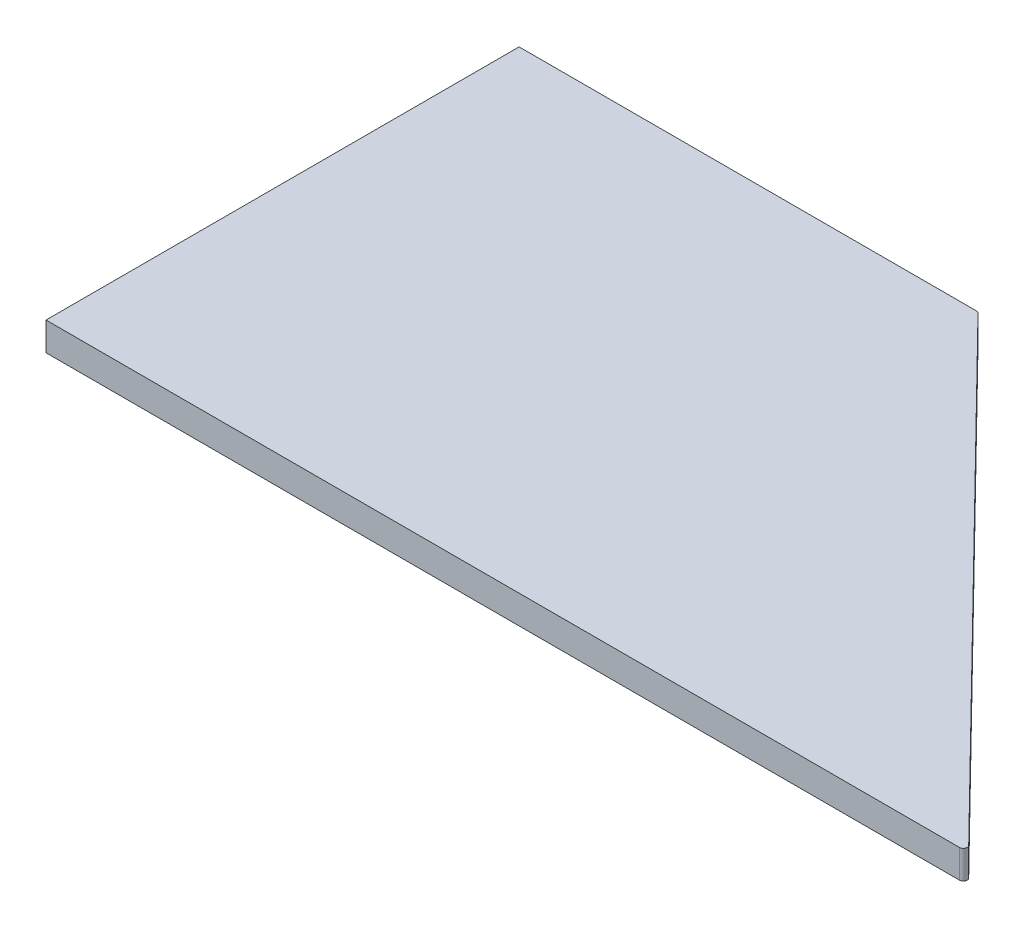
SolidWorks part; units mm, degrees
ref_plane "Piano frontale" through (0, 0, 0) normal (0, 0, 1) x (1, 0, 0)
ref_plane "Piano superiore" through (0, 0, 0) normal (0, 1, 0) x (1, 0, 0)
ref_plane "Piano destro" through (0, 0, 0) normal (1, 0, 0) x (0, 0, -1)
sketch "Schizzo1" plane through (0, 0, 0) normal (0, 1, 0) x (1, 0, 0)
  line L0 (208.3962, -265) -> (698.3962, -265)
  line L1 (-276.6038, -265) -> (208.3962, -265)
  line L2 (-276.6038, -265) -> (-276.6038, 235)
  line L3 (-276.6038, 235) -> (208.3962, 235)
  line L4 (208.3962, 235) -> (698.3962, -265)
  point P0 (0, 0)
extrude "Estrusione-Estrusione1" add sketch "Schizzo1" along normal blind 30
fillet "Raccordo2" radius 4 1 edges at (698.3962, 15, 265)
fillet "Raccordo3" radius 4 1 edges at (208.3962, 15, -235)
